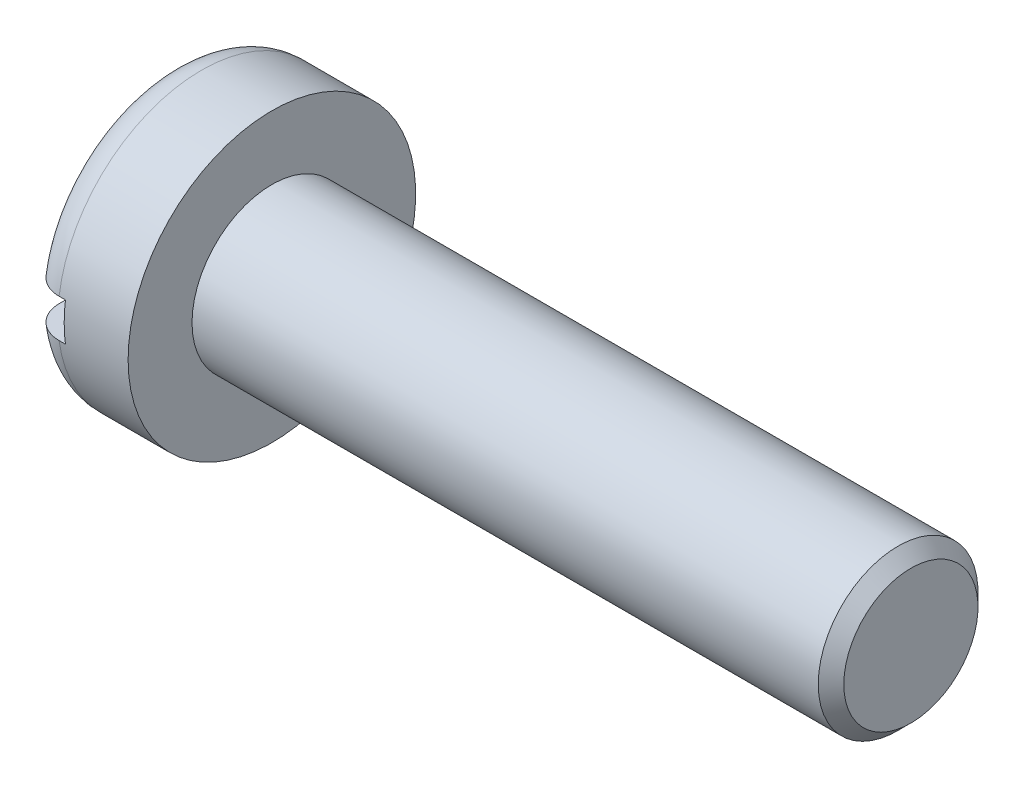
SolidWorks part; units mm, degrees
ref_plane "Face" through (0, 0, 0) normal (0, 0, 1) x (1, 0, 0)
ref_plane "Dessus" through (0, 0, 0) normal (0, 1, 0) x (1, 0, 0)
ref_plane "Droite" through (0, 0, 0) normal (1, 0, 0) x (0, 0, -1)
sketch "Esquisse1" plane through (0, 0, 0) normal (0, 0, 1) x (1, 0, 0)
  line L0 (-28.9827, 0) -> (28.9827, 0) construction
  line L1 (-1.6, 0) -> (-1.6, 2.25)
  line L2 (-1.6, 2.25) -> (0, 2.25)
  line L3 (0, 2.25) -> (0, 1.25)
  line L4 (0, 1.25) -> (10, 1.25)
  line L5 (10, 1.25) -> (10, 0)
  line L6 (10, 0) -> (-1.6, 0)
  dimension "D1" = 1.25
  dimension "D2" = 10
  dimension "D3" = 2.25
  dimension "D4" = 1.6
revolve "Base-Révolution" add sketch "Esquisse1" angle 360 about L0
chamfer "Chanfrein1" distance 0.2 angle 45 1 edges at (10, 0, 1.25)
fillet "Congé1" radius 0.5 1 edges at (-1.6, 0, 2.25)
sketch "Esquisse2" plane through (-1.6, 0, 0) normal (-1, 0, 0) x (0, 0, 1)
  line L0 (0.5774, -1) -> (-0.5774, -1)
  line L1 (-0.5774, -1) -> (-1.1547, 0)
  line L2 (-1.1547, 0) -> (-0.5774, 1)
  line L3 (-0.5774, 1) -> (0.5774, 1)
  line L4 (0.5774, 1) -> (1.1547, 0)
  line L5 (1.1547, 0) -> (0.5774, -1)
  circle A0 centre (0, 0) radius 1 construction
  dimension "D1" = 2
  dimension "D2" = 120
  dimension "D3" = 120
  dimension "D4" = 120
  dimension "D5" = 120
extrude "Empreinte pour clé" [suppressed] cut sketch "Esquisse2" against normal blind 2.5
sketch "Esquisse3" plane through (0, 0, 0) normal (0, 0, 1) x (1, 0, 0)
  line L0 (-1.7679, 0.3) -> (-1, 0.3)
  line L1 (-1, 0.3) -> (-1, -0.3)
  line L2 (-1, -0.3) -> (-1.7679, -0.3)
  line L3 (-1.7679, -0.3) -> (-1.7679, 0.3)
  line L4 (0, 0) -> (6.9797, 0) construction
  line L5 (-28.9827, 0) -> (28.9827, 0) construction
  line L7 (-1.6, 1.75) -> (-1.6, -1.75) construction
  line L8 (-1.6, 1.75) -> (-1.6, -1.75) construction
  dimension "D1" = 0.6
  dimension "D2" = 0.6
extrude "Enlèv. mat.-Extru.1" cut sketch "Esquisse3" against normal mid plane 10
